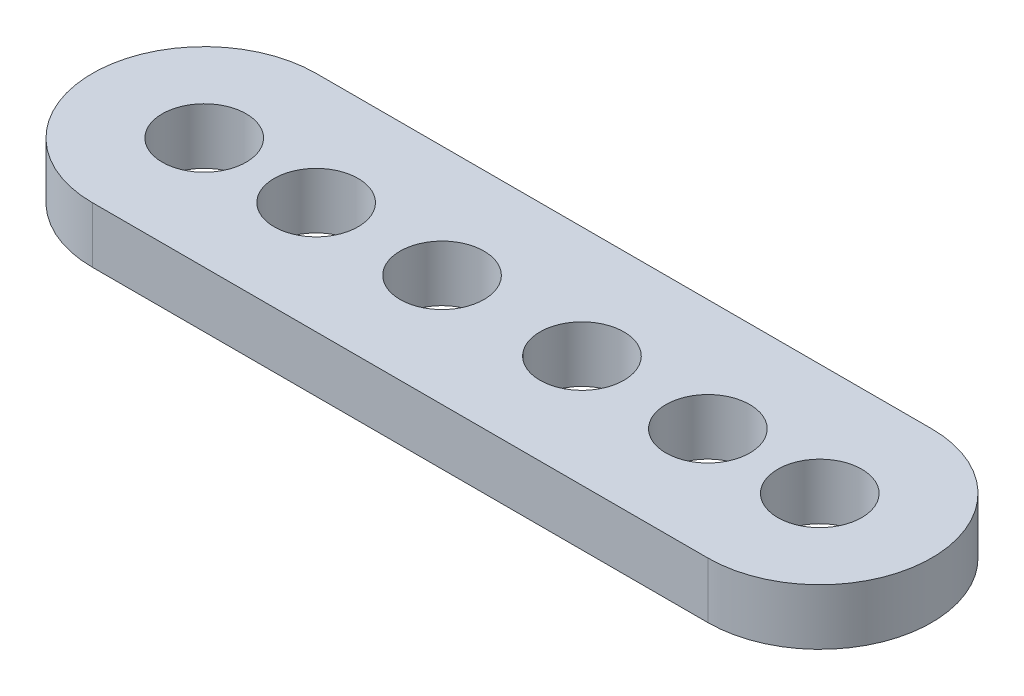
SolidWorks part; units mm, degrees
ref_plane "Front" through (0, 0, 0) normal (0, 0, 1) x (1, 0, 0)
ref_plane "Top" through (0, 0, 0) normal (0, 1, 0) x (1, 0, 0)
ref_plane "Right" through (0, 0, 0) normal (1, 0, 0) x (0, 0, -1)
sketch "草图2" plane through (0, 0, 0) normal (0, 1, 0) x (1, 0, 0)
  line L0 (0, 0) -> (22, 0) construction
  line L1 (0, 4) -> (22, 4)
  line L2 (0, -4) -> (22, -4)
  arc A0 (0, 4) -> (0, -4) centre (0, 0) ccw
  arc A1 (22, -4) -> (22, 4) centre (22, 0) ccw
  circle A2 centre (0, 0) radius 1.5
  circle A3 centre (4, 0) radius 1.5
  circle A4 centre (8.5, 0) radius 1.5
  circle A5 centre (13.5, 0) radius 1.5
  circle A6 centre (18, 0) radius 1.5
  circle A7 centre (22, 0) radius 1.5
  point P3 (11, 0)
  point P20 (0, 0)
  point P21 (0, 0)
  dimension "D2" = 4
  dimension "D3" = 3
  dimension "D4" = 3
  dimension "D5" = 3
  dimension "D6" = 3
  dimension "D7" = 3
  dimension "D8" = 3
  dimension "D1" = 22
  dimension "D9" = 0
  dimension "D10" = 5
  dimension "D11" = 2.5
  dimension "D12" = 14
  dimension "D13" = 7
extrude "凸台-拉伸1" add sketch "草图2" along normal blind 2
